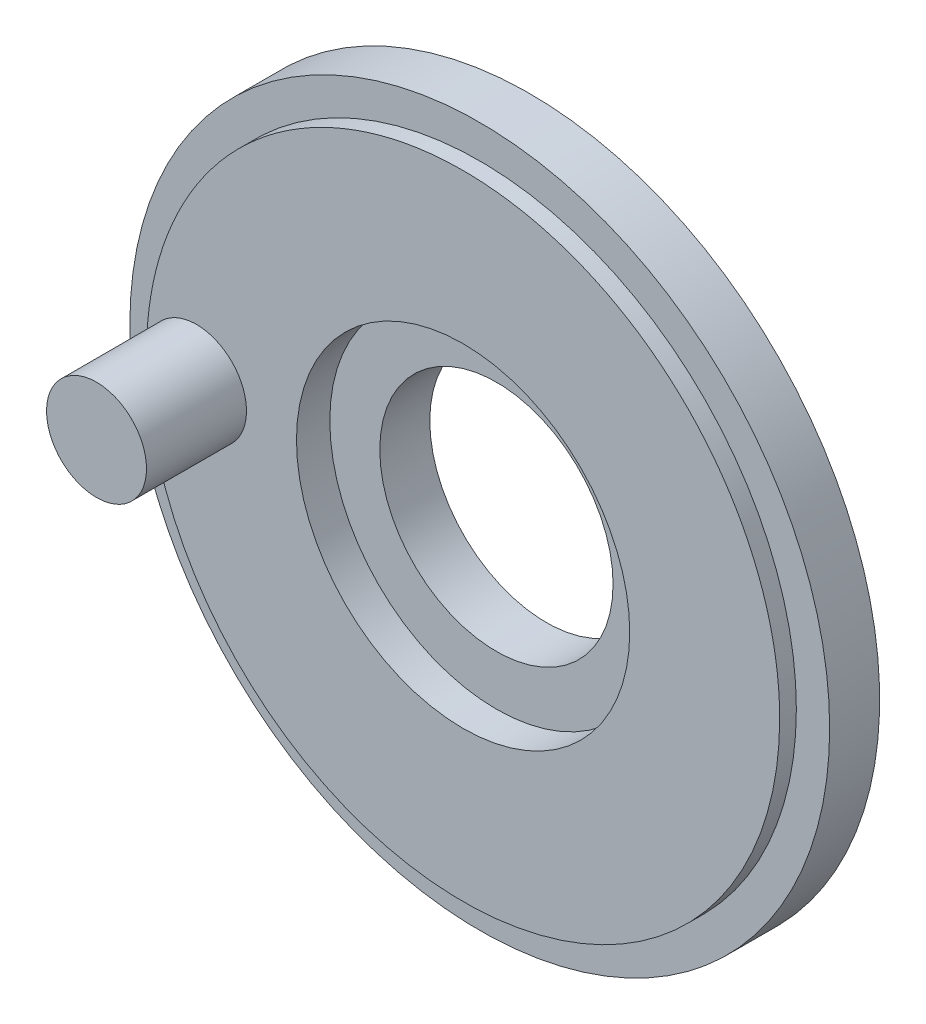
SolidWorks part; units mm, degrees
ref_plane "Plan1" through (0, 0, 0) normal (0, 0, 1) x (1, 0, 0)
ref_plane "Plan2" through (0, 0, 0) normal (0, 1, 0) x (1, 0, 0)
ref_plane "Plan3" through (0, 0, 0) normal (1, 0, 0) x (0, 0, -1)
sketch "Esquisse1" plane through (0, 0, 0) normal (0, 0, 1) x (1, 0, 0)
  circle A0 centre (0, 0) radius 10.5
  circle A1 centre (0, 0) radius 3.5
  dimension "D1" = 21
  dimension "D2" = 7
extrude "Base-Extrusion" add sketch "Esquisse1" along normal blind 2.5
sketch "Esquisse2" plane through (0, 0, 2.5) normal (0, 0, 1) x (1, 0, 0)
  circle A0 centre (0, 0) radius 9.5
  circle A2 centre (0, 0) radius 20
  dimension "D1" = 19
extrude "Enlèv. mat.-Extru.1" cut sketch "Esquisse2" against normal blind 0.5
sketch "Esquisse3" plane through (0, 0, 2.5) normal (0, 0, 1) x (1, 0, 0)
  circle A0 centre (0, 0) radius 5
  dimension "D1" = 10
extrude "Enlèv. mat.-Extru.2" cut sketch "Esquisse3" against normal blind 1
sketch "Esquisse4" plane through (0, 0, 2.5) normal (0, 0, 1) x (1, 0, 0)
  circle A0 centre (-8, 0) radius 1.5
  dimension "D1" = 3
  dimension "D2" = 8
extrude "Boss.-Extru.1" add sketch "Esquisse4" along normal blind 3
sketch "Esquisse5" plane through (0, 0, 0) normal (0, 0, -1) x (-1, 0, 0)
  circle A0 centre (0, 0) radius 5.5
  circle A1 centre (0, 0) radius 8.5
  dimension "D1" = 11
  dimension "D2" = 17
extrude "Enlèv. mat.-Extru.3" cut sketch "Esquisse5" against normal blind 1.5
sketch "Esquisse6" plane through (0, 0, 0) normal (0, 0, -1) x (-1, 0, 0)
  circle A0 centre (0, 0) radius 7.5
  circle A1 centre (0, 0) radius 14.1421
  dimension "D1" = 15
extrude "Enlèv. mat.-Extru.4" cut sketch "Esquisse6" against normal blind 0.5
